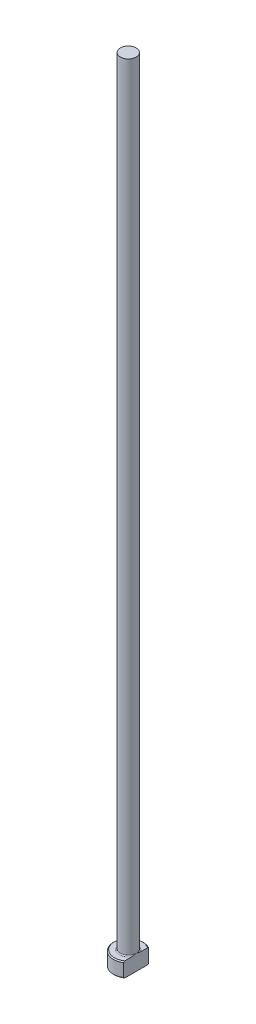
SolidWorks part; units mm, degrees
ref_plane "Front Plane" through (0, 0, 0) normal (0, 0, 1) x (1, 0, 0)
ref_plane "Top Plane" through (0, 0, 0) normal (0, 1, 0) x (1, 0, 0)
ref_plane "Right Plane" through (0, 0, 0) normal (1, 0, 0) x (0, 0, -1)
sketch "Sketch1" plane through (0, 0, 0) normal (0, 0, 1) x (1, 0, 0)
  line L0 (0, 259.9588) -> (0, -15.1925) construction
  line L1 (0, 0) -> (-3, 0)
  line L2 (-3, 0) -> (-3, 3)
  line L3 (-3, 3) -> (-1.6, 3)
  line L4 (-1.6, 3) -> (-1.6, 160)
  line L5 (-1.6, 160) -> (0, 160)
  line L6 (0, 160) -> (0, 0)
  dimension "L" = 160
  dimension "H" = 6
  dimension "T" = 3
  dimension "D" = 3.2
revolve "Revolve1" add sketch "Sketch1" angle 360 about L0
chamfer "Chamfer1" distance 0.2 angle 45 2 edges at (0, 3, 3) (0, 0, 3)
fillet "Fillet1" radius 0.2 1 edges at (0, 3, 1.6)
sketch "Sketch2" plane through (0, 0, 0) normal (0, 1, 0) x (1, 0, 0)
  line L0 (1.6, 2.5377) -> (1.6, -2.5377)
  circle A0 centre (0, 0) radius 3 construction
  arc A1 (1.6, -2.5377) -> (1.6, 2.5377) centre (0, 0) ccw
  circle A2 centre (0, 0) radius 1.6 construction
extrude "KEY" cut sketch "Sketch2" along normal through all
